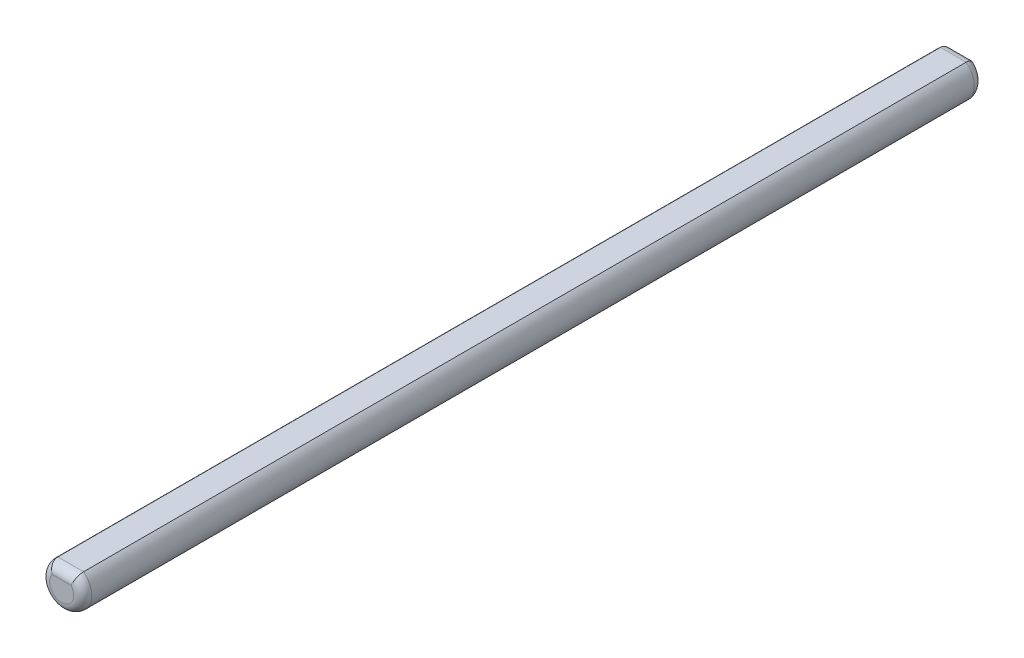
SolidWorks part; units mm, degrees
ref_plane "Front Plane" through (0, 0, 0) normal (0, 0, 1) x (1, 0, 0)
ref_plane "Top Plane" through (0, 0, 0) normal (0, 1, 0) x (1, 0, 0)
ref_plane "Right Plane" through (0, 0, 0) normal (1, 0, 0) x (0, 0, -1)
sketch "Sketch1" plane through (0, 0, 0) normal (0, 0, 1) x (1, 0, 0)
  line L0 (0, 1.845) -> (0, -2.335) construction
  line L1 (1.4312, 1.845) -> (-1.4312, 1.845)
  arc A0 (-1.4312, 1.845) -> (1.4312, 1.845) centre (0, 0) ccw
  point P3 (0, 1.845)
  point P5 (-1.7233, 1.5756)
  point P8 (0, 1.845)
  point P9 (0, 1.7169)
  dimension "D1" = 4.67
  dimension "D2" = 4.18
extrude "Boss-Extrude1" add sketch "Sketch1" along normal mid plane 100
fillet "Fillet1" radius 1 4 edges at (0, 1.845, -50) (0, -2.335, -50) (0, 1.845, 50) (0, -2.335, 50)
